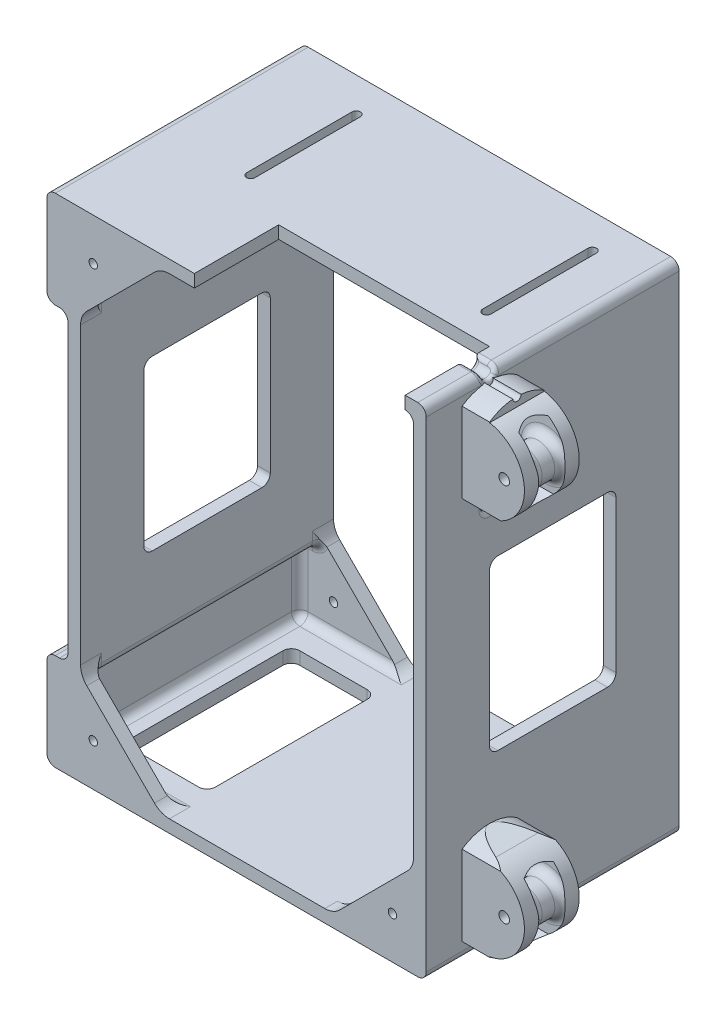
SolidWorks part; units mm, degrees
ref_plane "Plan de face" through (0, 0, 0) normal (0, 0, 1) x (1, 0, 0)
ref_plane "Plan de dessus" through (0, 0, 0) normal (0, 1, 0) x (1, 0, 0)
ref_plane "Plan de droite" through (0, 0, 0) normal (1, 0, 0) x (0, 0, -1)
sketch "Esquisse1" plane through (0, 0, 0) normal (0, 0, 1) x (1, 0, 0)
  line L0 (-3, 115) -> (-87, 115)
  line L1 (0, 0) -> (-90, 0)
  line L2 (0, 0) -> (0, 118)
  line L3 (0, 118) -> (-90, 118)
  line L4 (-90, 0) -> (-90, 20)
  line L5 (-87, 3) -> (-87, 20)
  line L6 (-3, 3) -> (-87, 3)
  line L7 (-3, 3) -> (-3, 115)
  line L8 (-90, 98) -> (-87, 98)
  line L9 (-90, 20) -> (-87, 20)
  line L10 (-87, 98) -> (-87, 115)
  line L11 (-90, 98) -> (-90, 118)
  line L12 (-87, 3) -> (-87, 115) construction
  line L14 (-90, 0) -> (-90, 118) construction
  dimension "D1" = 90
  dimension "D2" = 118
  dimension "D4" = 20
  dimension "D5" = 20
  dimension "D3" = 3
extrude "Boss.-Extru.2" add sketch "Esquisse1" along normal blind 60 contours L3 L11 L8 L10 L0 L7 L6 L5 L9 L4 L1 L2
ref_plane "Plan1" through (0, 0, 45) normal (0, 0, 1) x (1, 0, 0)
sketch "Esquisse2" plane through (0, 0, 0) normal (1, 0, 0) x (0, 0, -1)
  line L0 (-48.5, 112.246) -> (-48.5, 96.754)
  line L1 (-45, 84.9462) -> (-45, 52.4993) construction
  line L2 (-51.5, 113.9868) -> (-51.5, 95.0132)
  line L3 (-60, 0) -> (-60, 118) construction
  line L4 (-38.5, 113.9868) -> (-38.5, 95.0132)
  line L5 (-60, 118) -> (0, 118) construction
  line L6 (-76.0782, 45) -> (5.983, 45) construction
  line L7 (-41.5, 112.246) -> (-41.5, 96.754)
  line L10 (-81.25, 104.5) -> (-8.75, 104.5) construction
  arc A0 (-41.5, 96.754) -> (-48.5, 96.754) centre (-45, 104.5) cw
  arc A1 (-38.5, 113.9868) -> (-44.0009, 115.9565) centre (-45, 104.5) ccw
  arc A2 (-41.5, 112.246) -> (-48.5, 112.246) centre (-45, 104.5) ccw
  arc A3 (-45.9991, 115.9565) -> (-44.0009, 115.9565) centre (-45, 116) ccw
  arc A4 (-45.9991, 115.9565) -> (-51.5, 113.9868) centre (-45, 104.5) ccw
  arc A6 (-38.5, 113.9868) -> (-51.5, 113.9868) centre (-45, 104.5) ccw construction
  arc A7 (-38.5, 95.0132) -> (-51.5, 95.0132) centre (-45, 104.5) cw
  point P14 (-48.75, 57.5)
  point P16 (-61.25, 57.5)
extrude "Boss.-Extru.4" add sketch "Esquisse2" along normal blind 18.5
sketch "Esquisse5" plane through (0, 0, 45) normal (0, 0, 1) x (1, 0, 0)
  line L1 (0, 0) -> (0, 118) construction
  circle A0 centre (10, 104) radius 1.25
  point P6 (0, 59)
  dimension "D1" = 2.5
  dimension "D3" = 10
extrude "Enlèv. mat.-Extru.2" cut sketch "Esquisse5" against normal through all and the other way through all
sketch "Esquisse8" plane through (0, 0, 45) normal (0, 0, 1) x (1, 0, 0)
  circle A0 centre (10, 104) radius 4
  dimension "D1" = 8
extrude "Boss.-Extru.6" add sketch "Esquisse8" along normal up to surface and the other way up to surface
fillet "Congé3" radius 2 2 edges at (6, 104, 48.5) (14, 104, 41.5)
ref_plane "Plan2" through (0, 59, 0) normal (0, -1, 0) x (-1, 0, 0)
sketch "Esquisse9" plane through (0, 0, 60) normal (0, 0, 1) x (1, 0, 0)
  line L0 (-87, 98) -> (-82, 98)
  line L1 (-82, 98) -> (-82, 20)
  line L2 (-82, 20) -> (-87, 20)
  line L3 (-90, 20) -> (-90, 23)
  line L4 (-90, 23) -> (-85, 23)
  line L5 (-85, 23) -> (-85, 95)
  line L6 (-85, 95) -> (-90, 95)
  line L7 (-90, 95) -> (-90, 98)
  line L8 (-90, 98) -> (-87, 98)
  line L9 (-87, 20) -> (-90, 20)
  line L10 (-87, 98) -> (-87, 115) construction
  dimension "D1" = 3
  dimension "D2" = 3
  dimension "D3" = 3
  dimension "D4" = 5
extrude "Boss.-Extru.7" add sketch "Esquisse9" against normal up to surface (60 mm away)
sketch "Esquisse10" plane through (0, 0, 0) normal (0, -1, 0) x (1, 0, 0)
  line L0 (-82, 0) -> (-82, 60) construction
  line L1 (-82, 50) -> (-62, 50)
  line L2 (-82, 50) -> (-82, 10)
  line L3 (-82, 10) -> (-62, 10)
  line L4 (-62, 50) -> (-62, 10)
  line L5 (-90, 60) -> (-90, 0) construction
  point P8 (-90, 30)
extrude "Enlèv. mat.-Extru.3" cut sketch "Esquisse10" against normal up to next
sketch "Esquisse11" plane through (0, 118, 0) normal (0, 1, 0) x (1, 0, 0)
  line L0 (0, -60) -> (-90, -60) construction
  line L1 (-5, -60) -> (-55, -60)
  line L2 (-5, -60) -> (-5, -40)
  line L3 (-5, -40) -> (-55, -40)
  line L4 (-55, -60) -> (-55, -40)
  line L5 (0, -60) -> (0, 0) construction
  dimension "D1" = 20
  dimension "D2" = 50
  dimension "D3" = 5
extrude "Enlèv. mat.-Extru.4" cut sketch "Esquisse11" against normal up to next
sketch "Esquisse12" plane through (0, 0, 0) normal (1, 0, 0) x (0, 0, -1)
  line L2 (-30, 118) -> (-30, 0) construction
  line L3 (-60, 118) -> (0, 118) construction
  line L4 (-60, 0) -> (0, 0) construction
  line L6 (-45, 39) -> (-15, 39)
  line L7 (-45, 39) -> (-45, 79)
  line L8 (-45, 79) -> (-15, 79)
  line L9 (-15, 39) -> (-15, 79)
  line L10 (-45, 39) -> (-15, 79) construction
  line L11 (-45, 79) -> (-15, 39) construction
  point P0 (-30, 59)
  dimension "D1" = 40
  dimension "D2" = 30
extrude "Enlèv. mat.-Extru.5" cut sketch "Esquisse12" against normal through all
sketch "Esquisse13" plane through (0, 0, 0) normal (1, 0, 0) x (0, 0, -1)
  line L0 (-46.5, 104) -> (-43.5, 104) construction
  line L1 (-64.8515, 104) -> (-44.7368, 104) construction
  line L2 (-48.5, 104) -> (-51.5, 104) construction
  line L3 (-45, 121.2099) -> (-45, 85.4835) construction
  line L4 (-45, 38.5) -> (-45, -38.5) construction
  circle A0 centre (-45, 90.5) radius 1.5
  circle A1 centre (-45, 117.5) radius 1.5
  dimension "D1" = 3
  dimension "D2" = 13.5
extrude "Enlèv. mat.-Extru.6" cut sketch "Esquisse13" against normal up to next and the other way through all
fillet "Congé4" radius 2 29 edges at (-3, 3, 30) (-87, 3, 30) (-87, 20, 30) (-85, 23, 30) (-85, 95, 30) (-87, 98, 30) (-87, 115, 30) (-3, 115, 30) (0, 0, 30) (-90, 0, 30) (-82, 20, 30) (-90, 23, 30) (-90, 95, 30) (-90, 118, 30) (0, 118, 21.7929) (0, 118, 53.2071) (-82, 98, 30) (-62, 1.5, 50) (-82, 1.5, 50) (-62, 1.5, 10) (-82, 1.5, 10) (-83.5, 39, 15) (-83.5, 39, 45) (-83.5, 79, 45) (-83.5, 79, 15) (-1.5, 79, 15) (-1.5, 79, 45) (-1.5, 39, 45) (-1.5, 39, 15)
sketch "Esquisse14" plane through (0, 0, 0) normal (0, 0, -1) x (-1, 0, 0)
  line L0 (85, 93) -> (-3.2573, 93) construction
  line L2 (85, 93) -> (60, 118)
  line L3 (-18.5, 93) -> (0, 93) construction
  line L4 (0, 93) -> (25, 118)
  line L5 (0, 59) -> (87, 59) construction
  line L6 (-49.5094, 59) -> (49.5094, 59) construction
  line L7 (85, 25) -> (60, 0)
  line L8 (0, 116) -> (0, 2)
  line L9 (2, 0) -> (88, 0)
  line L10 (90, 2) -> (90, 21)
  line L11 (88, 23) -> (87, 23)
  line L12 (85, 25) -> (85, 93)
  line L13 (87, 95) -> (88, 95)
  line L14 (90, 97) -> (90, 116)
  line L15 (88, 118) -> (2, 118)
  line L16 (0, 116) -> (0, 93)
  line L17 (2, 0) -> (25, 0)
  line L18 (90, 2) -> (90, 21)
  line L19 (88, 23) -> (87, 23)
  line L21 (87, 95) -> (88, 95)
  line L22 (90, 97) -> (90, 116)
  line L23 (88, 118) -> (60, 118)
  line L24 (0, 25) -> (25, 0)
  line L25 (25, 118) -> (2, 118)
  line L26 (0, 25) -> (0, 2)
  line L27 (60, 0) -> (88, 0)
  circle A0 centre (79, 108) radius 1
  circle A1 centre (8, 108) radius 1
  circle A2 centre (79, 10) radius 1
  circle A3 centre (8, 10) radius 1
  arc A8 (0, 2) -> (2, 0) centre (2, 2) ccw
  arc A9 (88, 0) -> (90, 2) centre (88, 2) ccw
  arc A10 (90, 21) -> (88, 23) centre (88, 21) ccw
  arc A11 (85, 25) -> (87, 23) centre (87, 25) ccw
  arc A12 (87, 95) -> (85, 93) centre (87, 93) ccw
  arc A13 (88, 95) -> (90, 97) centre (88, 97) ccw
  arc A14 (90, 116) -> (88, 118) centre (88, 116) ccw
  arc A15 (2, 118) -> (0, 116) centre (2, 116) ccw
  arc A16 (0, 2) -> (2, 0) centre (2, 2) ccw
  arc A17 (88, 0) -> (90, 2) centre (88, 2) ccw
  arc A18 (90, 21) -> (88, 23) centre (88, 21) ccw
  arc A19 (85, 25) -> (87, 23) centre (87, 25) ccw
  arc A20 (87, 95) -> (85, 93) centre (87, 93) ccw
  arc A21 (88, 95) -> (90, 97) centre (88, 97) ccw
  arc A22 (90, 116) -> (88, 118) centre (88, 116) ccw
  arc A23 (2, 118) -> (0, 116) centre (2, 116) ccw
  dimension "D4" = 2
  dimension "D6" = 10
  dimension "D7" = 2
  dimension "D8" = 8
  dimension "D9" = 10
  dimension "D2" = 45
  dimension "D3" = 45
  dimension "D5" = 11
  dimension "D1" = 0
extrude "Boss.-Extru.8" add sketch "Esquisse14" against normal blind 3
pattern_linear "Répétition linéaire1" count 2 spacing 57 along (0, 0, 1) of "Boss.-Extru.8"
sketch "Esquisse15" plane through (0, 0, 57) normal (0, 0, -1) x (-1, 0, 0)
  line L4 (5, 118) -> (5, 115)
  line L5 (3, 113) -> (3, 96)
  line L6 (3, 96) -> (25, 118)
  line L7 (25, 118) -> (5, 118)
  line L8 (5, 118) -> (5, 115)
  line L9 (3, 113) -> (3, 96)
  line L10 (3, 96) -> (25, 118)
  line L11 (25, 118) -> (5, 118)
  arc A1 (5, 115) -> (3, 113) centre (5, 113) ccw
  arc A2 (5, 115) -> (3, 113) centre (5, 113) ccw
  dimension "D1" = 0
extrude "Enlèv. mat.-Extru.7" cut sketch "Esquisse15" against normal through all
sketch "Esquisse16" plane through (0, 0, 45) normal (0, 0, 1) x (1, 0, 0)
  line L0 (6.5329, 113.8481) -> (6.5329, 116)
  line L1 (6.5329, 94.1519) -> (0, 93)
  line L3 (0, 93) -> (18.5, 93) construction
  line L4 (18.5, 115.9565) -> (18.5, 93)
  line L5 (18.5, 93) -> (0, 93)
  line L7 (18.5, 116) -> (0, 116) construction
  line L8 (-0.6225, 104) -> (19.5876, 104) construction
  line L9 (6.5329, 116) -> (18.5, 115.9565)
  arc A0 (14.7964, 104) -> (6.5329, 94.1519) centre (4.7964, 104) cw
  arc A1 (14.7964, 104) -> (6.5329, 113.8481) centre (4.7964, 104) ccw
  dimension "D1" = 10
  dimension "D3" = 10
extrude "Enlèv. mat.-Extru.8" cut sketch "Esquisse16" against normal through all both and the other way through all
sketch "Esquisse17" plane through (0, 0, 0) normal (1, 0, 0) x (0, 0, -1)
  line L4 (-41.5, 96.754) -> (-41.5, 112.246)
  line L5 (-41.5, 96.754) -> (-41.5, 112.246)
  line L6 (-48.5, 112.246) -> (-48.5, 96.754)
  line L7 (-48.5, 112.246) -> (-48.5, 96.754)
  arc A4 (-41.5, 112.246) -> (-48.5, 112.246) centre (-45, 104.5) ccw
  arc A5 (-41.5, 112.246) -> (-48.5, 112.246) centre (-45, 104.5) ccw
  arc A6 (-48.5, 96.754) -> (-41.5, 96.754) centre (-45, 104.5) ccw
  arc A7 (-48.5, 96.754) -> (-41.5, 96.754) centre (-45, 104.5) ccw
  dimension "D1" = 0
extrude "Enlèv. mat.-Extru.9" cut sketch "Esquisse17" against normal up to next
mirror "Symétrie3" about plane through (0, 59, 0) normal (0, -1, 0) of "Enlèv. mat.-Extru.8", "Enlèv. mat.-Extru.9", "Congé3", "Enlèv. mat.-Extru.2", "Boss.-Extru.4", "Boss.-Extru.6"
fillet "Congé5" radius 5 14 edges at (-82, 96, 58.5) (-63, 115, 58.5) (-82, 96, 1.5) (-63, 115, 1.5) (-22, 115, 1.5) (-3, 96, 1.5) (-63, 3, 58.5) (-82, 22, 58.5) (-82, 22, 1.5) (-63, 3, 1.5) (-22, 3, 1.5) (-22, 3, 58.5) (-3, 22, 58.5) (-3, 22, 1.5)
fillet "Congé6" radius 2 36 edges at (-3, 14.5355, 3) (-3.5858, 3.5858, 3) (-3, 103.4645, 3) (-3.5858, 114.4142, 3) (-82, 94.9645, 3) (-82.5858, 97.4142, 3) (-84.5, 98, 3) (-86.4142, 98.5858, 3) (-87, 106.5, 3) (-86.4142, 114.4142, 3) (-82, 94.9645, 57) (-82.5858, 97.4142, 57) (-84.5, 98, 57) (-86.4142, 98.5858, 57) (-87, 106.5, 57) (-86.4142, 114.4142, 57) (-14.5355, 3, 3) (-14.5355, 115, 3) (-72.9645, 115, 3) (-72.9645, 115, 57) (-82, 23.0355, 57) (-82.5858, 20.5858, 57) (-84.5, 20, 57) (-86.4142, 19.4142, 57) (-72.9645, 3, 57) (-86.4142, 3.5858, 57) (-87, 11.5, 57) (-82, 23.0355, 3) (-82.5858, 20.5858, 3) (-84.5, 20, 3) (-86.4142, 19.4142, 3) (-87, 11.5, 3) (-86.4142, 3.5858, 3) (-72.9645, 3, 3) (-3, 22, 45) (-3, 96, 45)
sketch "Esquisse18" plane through (0, 115, 0) normal (0, -1, 0) x (1, 0, 0)
  line L0 (-5, 3) -> (-20, 3) construction
  line L1 (-5, 40) -> (-55, 40) construction
  line L2 (-8, 40) -> (-3, 40)
  line L3 (-8, 40) -> (-8, 3)
  line L4 (-8, 3) -> (-3, 3)
  line L5 (-3, 40) -> (-3, 3)
  line L7 (-3, 45) -> (-3, 5) construction
  dimension "D1" = 5
  dimension "D2" = 5
extrude "Boss.-Extru.9" add sketch "Esquisse18" along normal blind 2
fillet "Congé7" radius 2 3 edges at (-6.5, 113, 3) (-3.5858, 113, 3.5858) (-3, 113, 22.5)
sketch "Esquisse19" plane through (0, 118, 0) normal (0, 1, 0) x (1, 0, 0)
  line L0 (-68.5, -38.5217) -> (-68.5, -3.2296) construction
  line L1 (-12.5, -38.5217) -> (-12.5, -3) construction
  line L2 (-12.5, -33.1377) -> (-12.5, -8.106) construction
  line L3 (-13.5, -33.1377) -> (-13.5, -8.106)
  line L4 (-11.5, -33.1377) -> (-11.5, -8.106)
  line L5 (-68.5, -33.1377) -> (-68.5, -8.106) construction
  line L9 (-69.5, -33.1377) -> (-69.5, -8.106)
  line L10 (-8, -3) -> (-20, -3) construction
  line L12 (-67.5, -33.1377) -> (-67.5, -8.106)
  arc A0 (-13.5, -33.1377) -> (-11.5, -33.1377) centre (-12.5, -33.1377) ccw
  arc A1 (-11.5, -8.106) -> (-13.5, -8.106) centre (-12.5, -8.106) ccw
  arc A2 (-69.5, -33.1377) -> (-67.5, -33.1377) centre (-68.5, -33.1377) ccw
  arc A3 (-67.5, -8.106) -> (-69.5, -8.106) centre (-68.5, -8.106) ccw
  point P8 (-12.5, -20.6219)
  point P17 (-68.5, -20.6219)
  dimension "D1" = 1
  dimension "D2" = 2
extrude "Enlèv. mat.-Extru.10" cut sketch "Esquisse19" against normal up to next
fillet "Congé8" [suppressed] radius 1
fillet "Congé9" radius 1 7 edges at (-3.5, 118, 46.4142) (-0.1314, 116.7129, 46.2769) (-3.5, 118, 43.5858) (-0.2989, 117.0518, 43.5685) (-5, 116, 45) (0, 90.5, 46.5) (-3, 90.5, 46.5)
equation "\"D4@Esquisse2\"=\"D2@Esquisse2\"/2"
equation "\"D2@Esquisse10\"=\"D1@Esquisse10\"/2"
